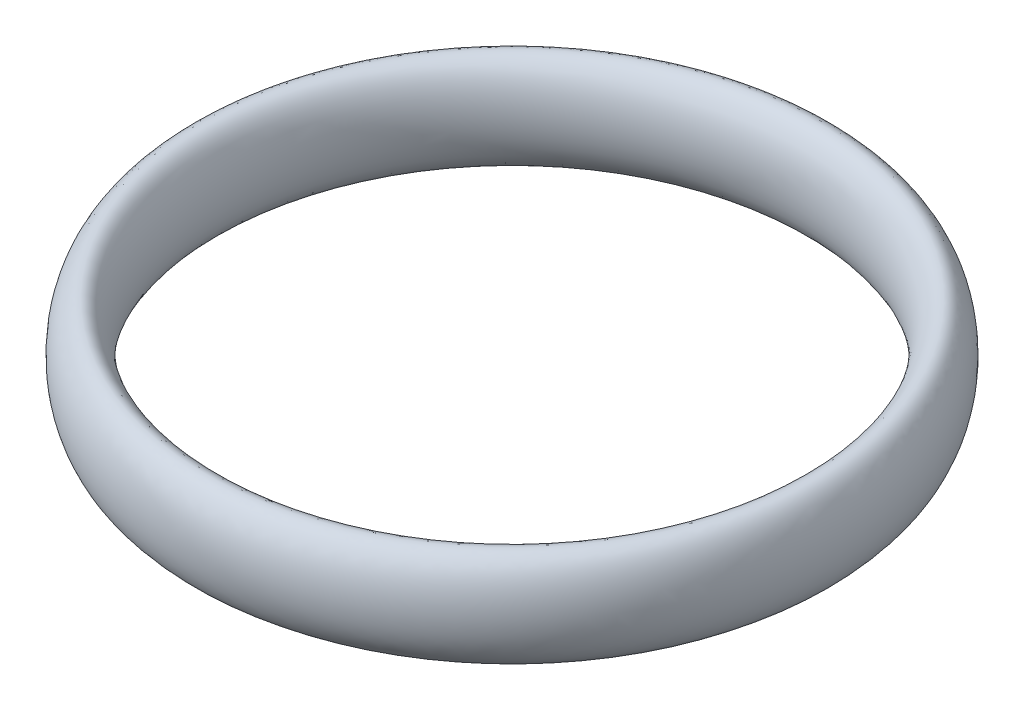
SolidWorks part; units mm, degrees
ref_plane "Plane1" through (0, 0, 0) normal (0, 0, 1) x (1, 0, 0)
ref_plane "Plane2" through (0, 0, 0) normal (0, 1, 0) x (1, 0, 0)
ref_plane "Plane3" through (0, 0, 0) normal (1, 0, 0) x (0, 0, -1)
sketch "Sketch1" plane through (0, 0, 0) normal (0, 0, 1) x (1, 0, 0)
  line L0 (0, 0) -> (0, 2.032) construction
  line L1 (6.35, 2.032) -> (6.35, 0) construction
  ellipse E0 centre (6.35, 1.016) end of major axis (6.35, 2.032) minor radius 0.508
  dimension "D1" = 2.032
  dimension "D2" = 1.016
  dimension "D3" = 5.842
revolve "Body" add sketch "Sketch1" angle 360 about L0
